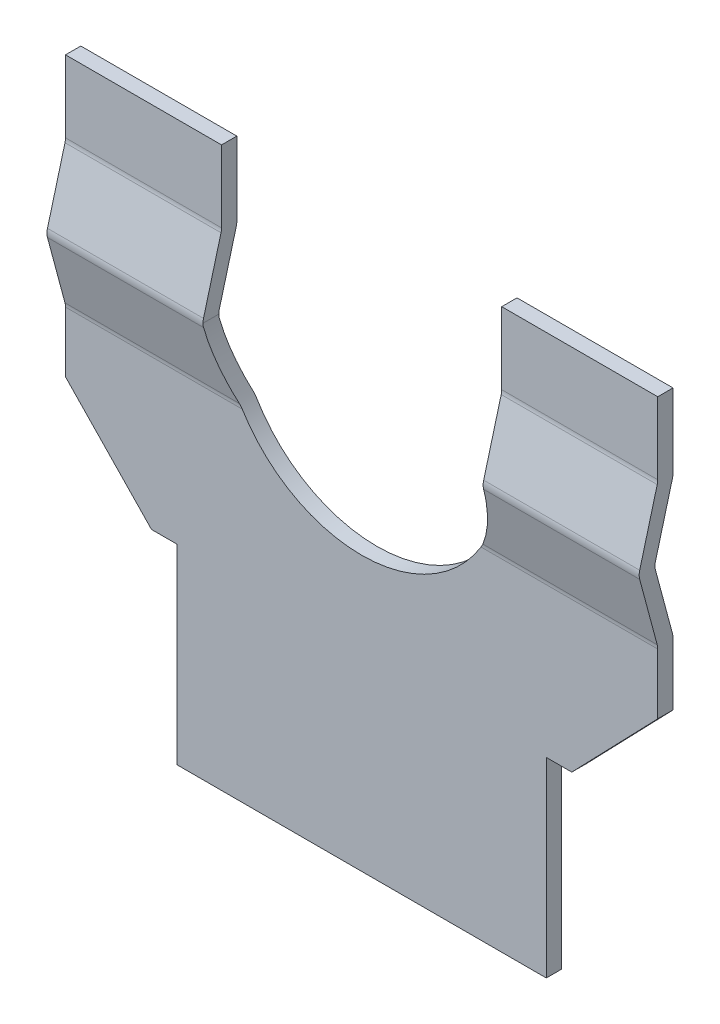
SolidWorks part; units mm, degrees
ref_plane "Face" through (0, 0, 0) normal (0, 0, 1) x (1, 0, 0)
ref_plane "Dessus" through (0, 0, 0) normal (0, 1, 0) x (1, 0, 0)
ref_plane "Droite" through (0, 0, 0) normal (1, 0, 0) x (0, 0, -1)
mirrored part "141 A_Rendre symétrique"
other "<141 A>-<Congé1>"
